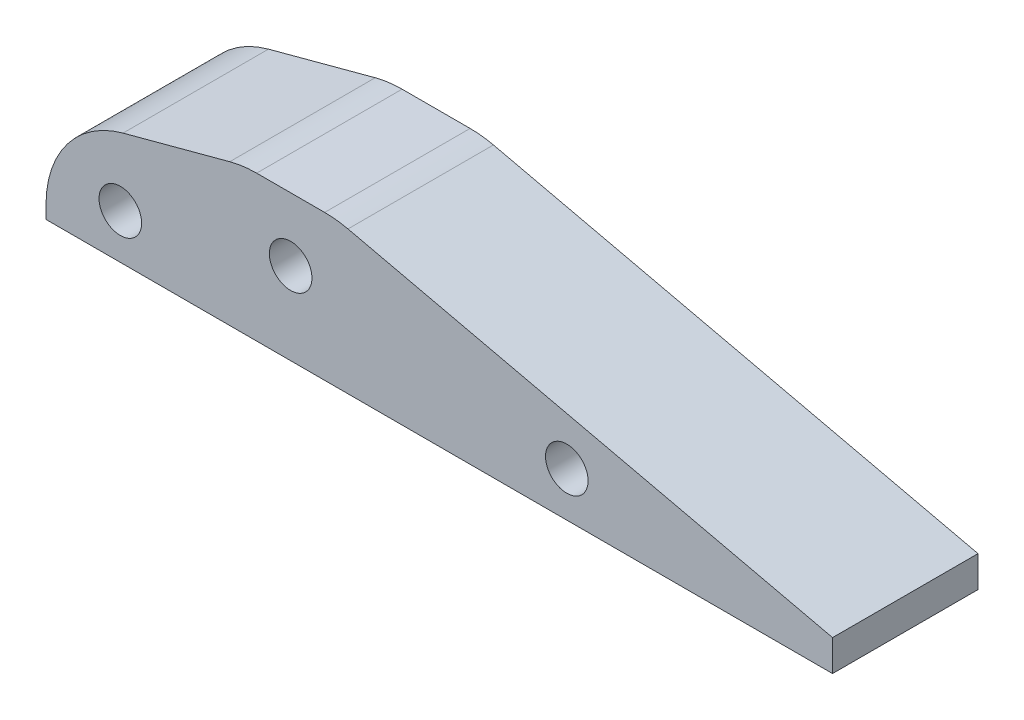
SolidWorks part; units mm, degrees
ref_plane "Front Plane" through (0, 0, 0) normal (0, 0, 1) x (1, 0, 0)
ref_plane "Top Plane" through (0, 0, 0) normal (0, 1, 0) x (1, 0, 0)
ref_plane "Right Plane" through (0, 0, 0) normal (1, 0, 0) x (0, 0, -1)
sketch "Sketch1" plane through (0, 0, 0) normal (0, 0, 1) x (1, 0, 0)
  line L0 (0, 0) -> (0, 8.92)
  line L1 (0, 8.92) -> (18.9588, 14)
  line L2 (18.9588, 14) -> (27.9588, 14)
  line L3 (27.9588, 14) -> (75.7082, 3)
  line L4 (75.7082, 3) -> (75.7082, 0)
  line L5 (75.7082, 0) -> (0, 0)
  line L6 (0, 0) -> (0, 23.7543) construction
  dimension "D1" = 8.92
  dimension "D2" = 75
  dimension "D3" = 9
  dimension "D4" = 14
  dimension "D5" = 49
  dimension "D6" = 3
extrude "Boss-Extrude1" add sketch "Sketch1" along normal blind 14
fillet "Fillet1" radius 10 1 edges at (0, 8.92, 7)
fillet "Fillet2" radius 10 2 edges at (27.9588, 14, 7) (18.9588, 14, 7)
sketch "Sketch2" plane through (0, 0, 0) normal (0, 0, -1) x (-1, 0, 0)
  line L1 (-52.1792, 7.8436) -> (-54.2288, 4.2936)
  line L2 (-54.2288, 4.2936) -> (-52.1792, 0.7436)
  line L3 (-52.1792, 0.7436) -> (-48.0801, 0.7436)
  line L4 (-48.0801, 0.7436) -> (-46.0305, 4.2936)
  line L5 (-46.0305, 4.2936) -> (-48.0801, 7.8436)
  line L6 (-48.0801, 7.8436) -> (-52.1792, 7.8436)
  line L7 (-25.5982, 11.4569) -> (-27.6478, 7.9069)
  line L8 (-27.6478, 7.9069) -> (-25.5982, 4.3569)
  line L9 (-25.5982, 4.3569) -> (-21.499, 4.3569)
  line L10 (-21.499, 4.3569) -> (-19.4494, 7.9069)
  line L11 (-19.4494, 7.9069) -> (-21.499, 11.4569)
  line L12 (-21.499, 11.4569) -> (-25.5982, 11.4569)
  line L13 (-9.2046, 7.8436) -> (-11.2542, 4.2936)
  line L14 (-11.2542, 4.2936) -> (-9.2046, 0.7436)
  line L15 (-9.2046, 0.7436) -> (-5.1054, 0.7436)
  line L16 (-5.1054, 0.7436) -> (-3.0558, 4.2936)
  line L17 (-3.0558, 4.2936) -> (-5.1054, 7.8436)
  line L18 (-5.1054, 7.8436) -> (-9.2046, 7.8436)
  circle A0 centre (-50.1296, 4.2936) radius 3.55 construction
  circle A1 centre (-23.5486, 7.9069) radius 3.55 construction
  circle A2 centre (-7.155, 4.2936) radius 3.55 construction
extrude "Cut-Extrude1" cut sketch "Sketch2" against normal blind 5
sketch "Sketch3" plane through (0, 0, 5) normal (0, 0, -1) x (-1, 0, 0)
  circle A0 centre (-50.1296, 4.2936) radius 2.05
  circle A1 centre (-23.5486, 7.9069) radius 2.05
  circle A2 centre (-7.155, 4.2936) radius 2.05
  dimension "D1" = 4.1
extrude "Cut-Extrude2" cut sketch "Sketch3" against normal through all
